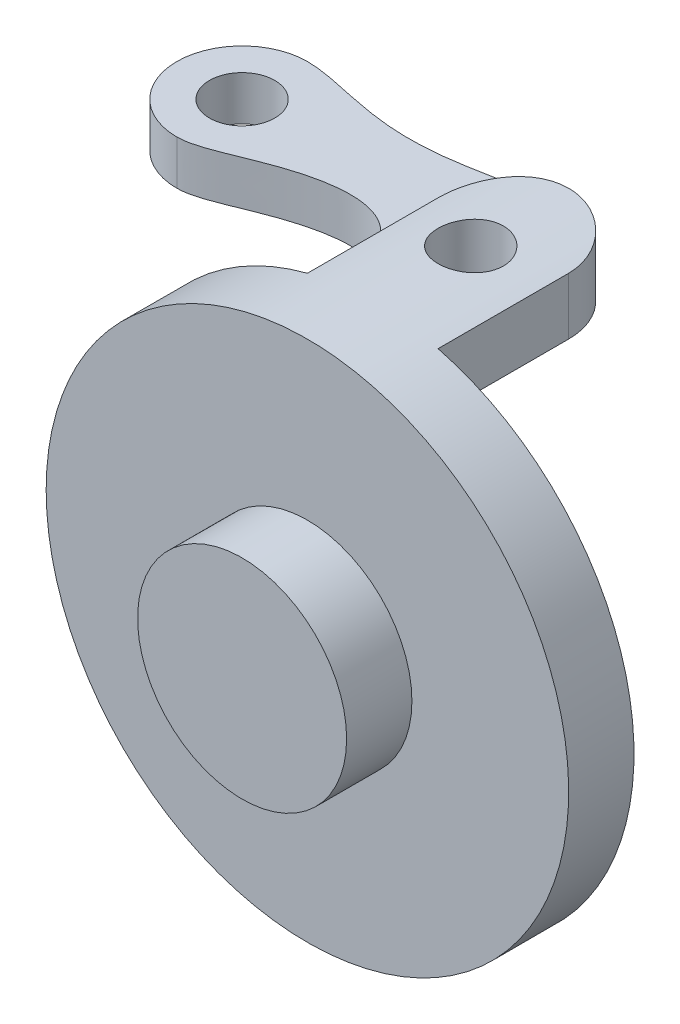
SolidWorks part; units mm, degrees
ref_plane "Front Plane" through (0, 0, 0) normal (0, 0, 1) x (1, 0, 0)
ref_plane "Top Plane" through (0, 0, 0) normal (0, 1, 0) x (1, 0, 0)
ref_plane "Right Plane" through (0, 0, 0) normal (1, 0, 0) x (0, 0, -1)
sketch "Sketch1" plane through (0, 0, 0) normal (0, 0, 1) x (1, 0, 0)
  circle A0 centre (0, 0) radius 80
extrude "Boss-Extrude1" add sketch "Sketch1" along normal blind 50
sketch "Sketch2" plane through (0, 0, 0) normal (0, 0, -1) x (-1, 0, 0)
  circle A0 centre (0, 0) radius 200
extrude "Boss-Extrude2" add sketch "Sketch2" along normal blind 50
sketch "Sketch3" plane through (0, 0, -50) normal (0, 0, -1) x (-1, 0, 0)
  line L0 (0, -200) -> (0, 200) construction
  line L6 (0, 0) -> (-59.0079, 0) construction
  line L12 (0, 150) -> (-50, 150)
  line L13 (-50, 150) -> (-50, 193.6492)
  line L14 (0, 150) -> (50, 150)
  line L15 (50, 150) -> (50, 193.6492)
  line L16 (50, -150) -> (50, -193.6492)
  line L17 (0, -150) -> (50, -150)
  line L18 (-50, -150) -> (-50, -193.6492)
  line L19 (0, -150) -> (-50, -150)
  circle A1 centre (0, 0) radius 200 construction
  arc A2 (50, 193.6492) -> (-50, 193.6492) centre (0, 0) ccw
  arc A3 (50, -193.6492) -> (-50, -193.6492) centre (0, 0) cw
  dimension "D1" = 150
  dimension "D2" = 50
  dimension "D3" = 50
extrude "Boss-Extrude4" add sketch "Sketch3" along normal blind 150
sketch "Sketch5" plane through (0, 150, 0) normal (0, -1, 0) x (1, 0, 0)
  line L0 (0, 0) -> (0, -125) construction
  circle A0 centre (0, -125) radius 25
extrude "Cut-Extrude2" cut sketch "Sketch5" against normal through all both and the other way through all
fillet "Fillet2" radius 50 4 edges at (-50, -171.8246, -200) (50, -171.8246, -200) (50, 171.8246, -200) (-50, 171.8246, -200)
sketch "Sketch6" plane through (0, 150, 0) normal (0, -1, 0) x (1, 0, 0)
  line L0 (-200, -100) -> (-250, -100)
  line L1 (-50, -150) -> (-50, -50) construction
  line L2 (-250, -100) -> (-250, -200)
  line L3 (-250, -200) -> (-200, -200)
  line L4 (-50, -100) -> (0, -200)
  line L5 (-250, -150) -> (-200, -150) construction
  line L7 (-200, -100) -> (-172.9033, -100) construction
  line L8 (-172.9033, -100) -> (-145.8851, -125) construction
  line L9 (-145.8851, -125) -> (-101.6053, -136.0916) construction
  line L10 (-101.6053, -136.0916) -> (-79.6906, -132.7893) construction
  line L11 (-79.6906, -132.7893) -> (-58.6764, -125) construction
  line L12 (-58.6764, -125) -> (-50, -100) construction
  line L15 (-200, -200) -> (-173.0238, -200) construction
  line L16 (-173.0238, -200) -> (-144.183, -186.7587) construction
  line L17 (-144.183, -186.7587) -> (-116.7321, -183.1101) construction
  line L18 (-116.7321, -183.1101) -> (-76.9908, -181.9425) construction
  line L19 (-76.9908, -181.9425) -> (-44.3867, -203.397) construction
  line L20 (-44.3867, -203.397) -> (0, -200) construction
  circle A0 centre (-200, -150) radius 25
  spline_without_curve S0
  spline_without_curve S1
  dimension "D4" = 90
  dimension "D1" = 100
  dimension "D2" = 200
  dimension "D3" = 50
  dimension "D5" = 90
  dimension "D6" = 50
  dimension "D7" = 50
extrude "Boss-Extrude5" add sketch "Sketch6" against normal blind 34
fillet "Fillet3" radius 50 1 edges at (-250, 167, -200)
fillet "Fillet4" radius 50 1 edges at (-250, 167, -100)
